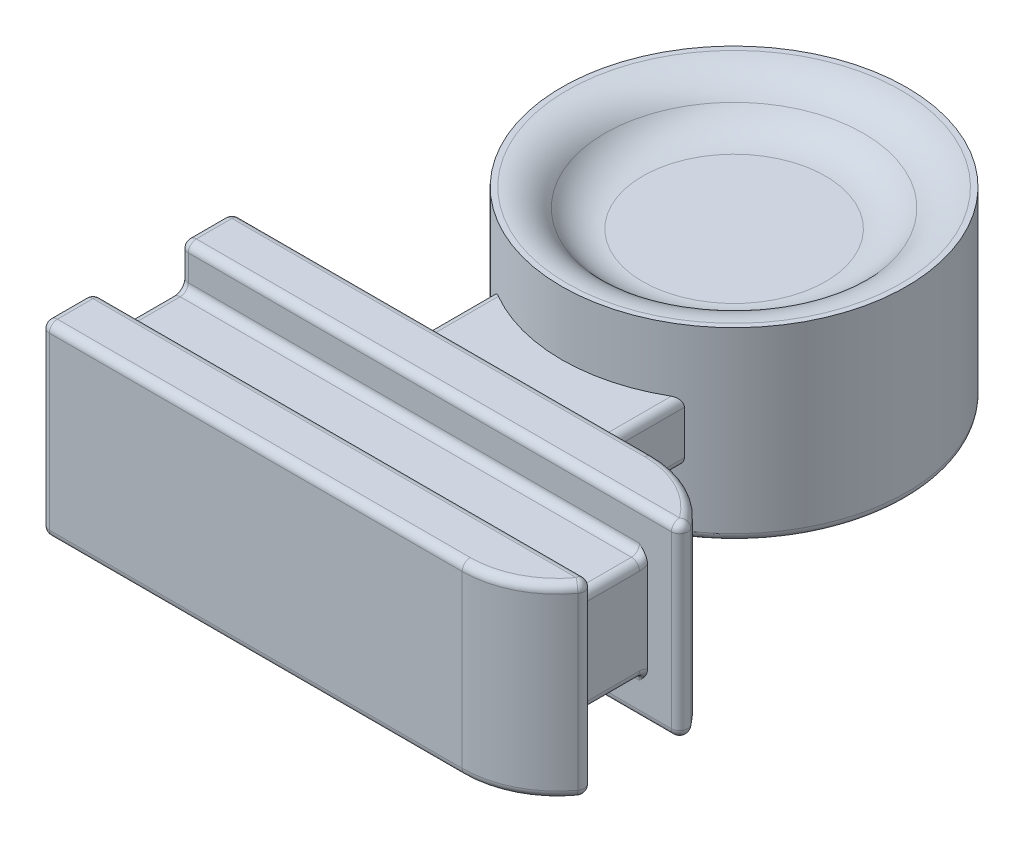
SolidWorks part; units mm, degrees
ref_plane "Front Plane" through (0, 0, 0) normal (0, 0, 1) x (1, 0, 0)
ref_plane "Top Plane" through (0, 0, 0) normal (0, 1, 0) x (1, 0, 0)
ref_plane "Right Plane" through (0, 0, 0) normal (1, 0, 0) x (0, 0, -1)
sketch "Sketch1" plane through (0, 0, 0) normal (0, 1, 0) x (1, 0, 0)
  line L1 (-2.9718, -4.5361) -> (2.9718, -4.5361)
  line L2 (-2.9718, -4.5361) -> (-2.9718, -8.4985)
  line L3 (-2.9718, -8.4985) -> (2.9718, -8.4985)
  line L4 (2.9718, -4.5361) -> (2.9718, -8.4985)
  line L5 (-7.2898, -8.4985) -> (8.9408, -8.4985)
  line L6 (-7.2898, -8.4985) -> (-7.2898, -14.4929)
  line L7 (-7.2898, -14.4929) -> (8.9408, -14.4929)
  line L8 (8.9408, -8.4985) -> (8.9408, -14.4929)
  circle A0 centre (0, 0) radius 5.4229
  dimension "D1" = 3.9624
  dimension "D3" = 10.8458
  dimension "D2" = 5.9436
  dimension "D4" = 16.2306
  dimension "D5" = 5.9944
  dimension "D6" = 5.969
extrude "Boss-Extrude1" add sketch "Sketch1" along normal blind 5.8674 contours L1 A0 | L1 A0 | A0 L2 L3 L4 | L8 L5 L3 L6 L7
sketch "Sketch2" plane through (0, 5.8674, 0) normal (0, 1, 0) x (1, 0, 0)
  line L1 (-2.9718, -8.4985) -> (2.9718, -8.4985)
  line L2 (-2.9718, -8.4985) -> (-2.9718, -4.5361)
  line L4 (2.9718, -8.4985) -> (2.9718, -4.5361)
  arc A0 (-2.9718, -4.5361) -> (2.9718, -4.5361) centre (0, 0) ccw
extrude "Cut-Extrude1" cut sketch "Sketch2" against normal blind 1.9939
sketch "Sketch3" plane through (0, 0, 0) normal (0, -1, 0) x (1, 0, 0)
  line L1 (2.9718, 8.4985) -> (-2.9718, 8.4985)
  line L2 (2.9718, 8.4985) -> (2.9718, 4.5361)
  line L4 (-2.9718, 8.4985) -> (-2.9718, 4.5361)
  arc A0 (2.9718, 4.5361) -> (-2.9718, 4.5361) centre (0, 0) ccw
extrude "Cut-Extrude2" cut sketch "Sketch3" against normal blind 1.9939
sketch "Sketch4" plane through (-7.2898, 0, 0) normal (-1, 0, 0) x (0, 0, 1)
  line L0 (8.4985, 5.8674) -> (10.1241, 5.8674)
  line L1 (8.4985, 5.8674) -> (14.4929, 5.8674) construction
  line L2 (10.1241, 5.8674) -> (10.1241, 4.5466)
  line L3 (10.1241, 4.5466) -> (12.8673, 4.5466)
  line L4 (12.8673, 4.5466) -> (12.8673, 5.8674)
  line L5 (12.8673, 5.8674) -> (14.4929, 5.8674)
  line L6 (14.4929, 5.8674) -> (14.4929, 0)
  line L7 (14.4929, 0) -> (12.8673, 0)
  line L8 (8.4985, 0) -> (14.4929, 0) construction
  line L9 (12.8673, 0) -> (12.8673, 1.3208)
  line L10 (12.8673, 1.3208) -> (10.1241, 1.3208)
  line L11 (10.1241, 1.3208) -> (10.1241, 0)
  line L12 (10.1241, 0) -> (8.4985, 0)
  line L13 (8.4985, 0) -> (8.4985, 5.8674)
  line L14 (10.1241, 5.8674) -> (12.8673, 5.8674)
  line L15 (10.1241, 0) -> (12.8673, 0)
  dimension "D1" = 1.6256
  dimension "D2" = 1.3208
  dimension "D3" = 1.3208
extrude "Cut-Extrude3" cut sketch "Sketch4" against normal through all contours L3 L4 L2 M3 | L10 L11 L9 M1
sketch "Sketch5" plane through (0, 5.8674, 0) normal (0, 1, 0) x (1, 0, 0)
  line L0 (5.9436, -8.4985) -> (8.9408, -8.4985)
  line L1 (8.9408, -8.4985) -> (8.9408, -11.4957)
  line L2 (8.9408, -11.4957) -> (8.9408, -14.4929)
  line L3 (8.9408, -14.4929) -> (5.9436, -14.4929)
  line L4 (7.402, -10.1241) -> (7.402, -12.8673)
  line L5 (8.9408, -10.1241) -> (-7.2898, -10.1241) construction
  line L6 (8.9408, -12.8673) -> (-7.2898, -12.8673) construction
  line L7 (7.402, -10.1241) -> (8.6085, -10.1241)
  line L8 (7.402, -12.8673) -> (8.6085, -12.8673)
  arc A0 (5.9436, -14.4929) -> (8.6085, -12.8673) centre (5.9436, -11.4957) ccw
  arc A1 (8.6085, -10.1241) -> (5.9436, -8.4985) centre (5.9436, -11.4957) ccw
extrude "Cut-Extrude5" cut sketch "Sketch5" against normal through all
sketch "Sketch6" plane through (0, 5.8674, 0) normal (0, 1, 0) x (1, 0, 0)
  circle A0 centre (0, 0) radius 3.7787
  dimension "D1" = 7.5574
extrude "Cut-Extrude6" cut sketch "Sketch6" against normal blind 1.143
sketch "Sketch7" plane through (0, 0, 0) normal (0, -1, 0) x (1, 0, 0)
  circle A0 centre (0, 0) radius 3.81
  dimension "D1" = 7.62
extrude "Cut-Extrude7" cut sketch "Sketch7" against normal blind 1.143
fillet "Fillet2" radius 1.524 1 edges at (0, 5.8674, 3.7787)
fillet "Fillet3" radius 1.524 1 edges at (0, 0, -3.81)
fillet "Fillet4" radius 1.524 1 edges at (0, 4.7244, 3.7787)
fillet "Fillet5" radius 1.524 1 edges at (0, 1.143, -3.81)
fillet "Fillet6" radius 0.254 4 edges at (0.0561, 1.3208, 12.8673) (0.0561, 1.3208, 10.1241) (0.0561, 4.5466, 12.8673) (0.0561, 4.5466, 10.1241)
fillet "Fillet7" radius 0.254 22 edges at (8.6085, 2.9337, 12.8673) (-7.2898, 0, 9.3113) (8.6085, 2.9337, 10.1241) (-7.2898, 2.9337, 14.4929) (-7.2898, 2.9337, 8.4985) (-7.2898, 1.3208, 11.4957) (-7.2898, 5.334, 12.8673) (-7.2898, 0.5334, 10.1241) (-7.2898, 5.8674, 9.3113) (-7.2898, 4.5466, 11.4957) (-7.2898, 1.2464, 12.7929) (-7.2898, 1.2464, 10.1985) (-7.2898, 4.621, 12.7929) (-7.2898, 4.621, 10.1985) (-7.2898, 5.8674, 13.6801) (-7.2898, 5.334, 10.1241) (-7.2898, 0, 13.6801) (-7.2898, 0.5334, 12.8673) (0.6594, 0, 10.1241) (0.6594, 0, 12.8673) (0.6594, 5.8674, 12.8673) (0.6594, 5.8674, 10.1241)
fillet "Fillet8" radius 0.254 20 edges at (7.2963, 5.8674, 8.8211) (7.2963, 0, 8.8211) (-0.5461, 0, 8.4985) (8.3946, 0, 9.7909) (-0.5461, 5.8674, 8.4985) (8.3946, 5.8674, 9.7909) (7.2963, 5.8674, 14.1703) (-0.5461, 5.8674, 14.4929) (8.3946, 5.8674, 13.2005) (-0.5461, 0, 14.4929) (7.2963, 0, 14.1703) (8.3946, 0, 13.2005) (-7.2154, 5.793, 14.4185) (8.3329, 5.793, 12.9417) (-7.2154, 0.0744, 14.4185) (8.3329, 0.0744, 12.9417) (8.3329, 5.793, 10.0497) (-7.2154, 5.793, 8.5729) (8.3329, 0.0744, 10.0497) (-7.2154, 0.0744, 8.5729)
fillet "Fillet9" radius 0.254 11 edges at (7.402, 1.2464, 10.1985) (7.402, 1.2464, 12.7929) (7.402, 4.621, 12.7929) (7.402, 4.621, 10.1985) (0, 0, 5.4229) (-2.9718, 1.9939, 6.5173) (-2.9718, 3.8735, 6.5173) (2.9718, 3.8735, 6.5173) (2.9718, 1.9939, 6.5173) (7.402, 1.3208, 11.4957) (7.402, 4.5466, 11.4957)
